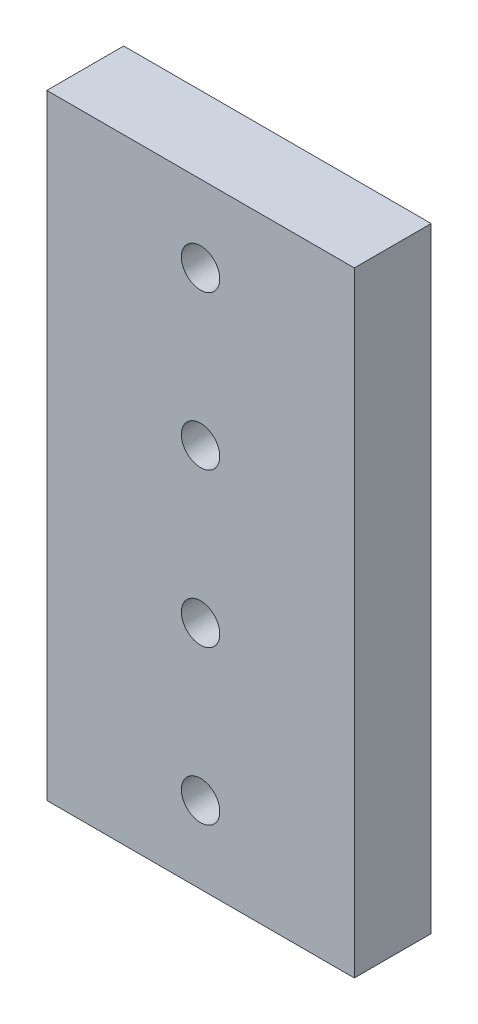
SolidWorks part; units mm, degrees
ref_plane "Front Plane" through (0, 0, 0) normal (0, 0, 1) x (1, 0, 0)
ref_plane "Top Plane" through (0, 0, 0) normal (0, 1, 0) x (1, 0, 0)
ref_plane "Right Plane" through (0, 0, 0) normal (1, 0, 0) x (0, 0, -1)
sketch "Sketch1" plane through (0, 0, 0) normal (0, 0, 1) x (1, 0, 0)
  line L1 (-12.7, -25.4) -> (12.7, -25.4)
  line L2 (-12.7, -25.4) -> (-12.7, 25.4)
  line L3 (-12.7, 25.4) -> (12.7, 25.4)
  line L4 (12.7, -25.4) -> (12.7, 25.4)
  line L5 (-12.7, -25.4) -> (12.7, 25.4) construction
  line L6 (-12.7, 25.4) -> (12.7, -25.4) construction
  point P0 (0, 0)
  dimension "D1" = 25.4
  dimension "D2" = 50.8
extrude "Boss-Extrude1" add sketch "Sketch1" along normal mid plane 6.35
sketch "Sketch3" plane through (0, 0, -3.175) normal (0, 0, -1) x (-1, 0, 0)
  line L0 (0, 32.7791) -> (0, -32.4945) construction
  line L1 (-12.7, 25.4) -> (12.7, 25.4) construction
  circle A0 centre (0, 19.05) radius 1.5875
  dimension "D2" = 3.175
  dimension "D1" = 6.35
extrude "Cut-Extrude2" cut sketch "Sketch3" against normal through all
pattern_linear "LPattern1" count 4 spacing 12.7 along (0, -1, 0) of "Cut-Extrude2"
